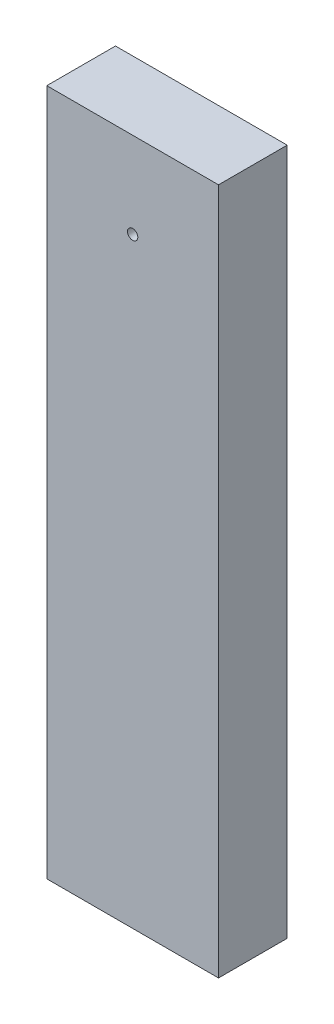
SolidWorks part; units mm, degrees
ref_plane "Plan de face" through (0, 0, 0) normal (0, 0, 1) x (1, 0, 0)
ref_plane "Plan de dessus" through (0, 0, 0) normal (0, 1, 0) x (1, 0, 0)
ref_plane "Plan de droite" through (0, 0, 0) normal (1, 0, 0) x (0, 0, -1)
sketch "Esquisse1" plane through (0, 0, 0) normal (0, 0, 1) x (1, 0, 0)
  line L1 (0, 0) -> (25, 0)
  line L2 (0, 0) -> (0, 100)
  line L3 (0, 100) -> (25, 100)
  line L4 (25, 0) -> (25, 100)
  dimension "D1" = 100
  dimension "D2" = 25
extrude "Boss.-Extru.1" add sketch "Esquisse1" along normal blind 10
sketch "Esquisse2" plane through (0, 0, 0) normal (0, -1, 0) x (1, 0, 0)
  line L0 (0, 10) -> (25, 10) construction
  line L1 (25, 10) -> (25, 0) construction
  circle A0 centre (12.5, 5) radius 0.75
  dimension "D1" = 1.5
  dimension "D2" = 5
  dimension "D3" = 12.5
extrude "Enlèv. mat.-Extru.1" cut sketch "Esquisse2" against normal blind 10
sketch "Esquisse3" plane through (0, 0, 10) normal (0, 0, 1) x (1, 0, 0)
  line L0 (25, 100) -> (0, 100) construction
  line L1 (0, 100) -> (0, 0) construction
  circle A0 centre (12.5, 87.5) radius 0.75
  dimension "D1" = 1.5
  dimension "D2" = 12.5
  dimension "D3" = 12.5
extrude "Enlèv. mat.-Extru.2" cut sketch "Esquisse3" against normal blind 5
